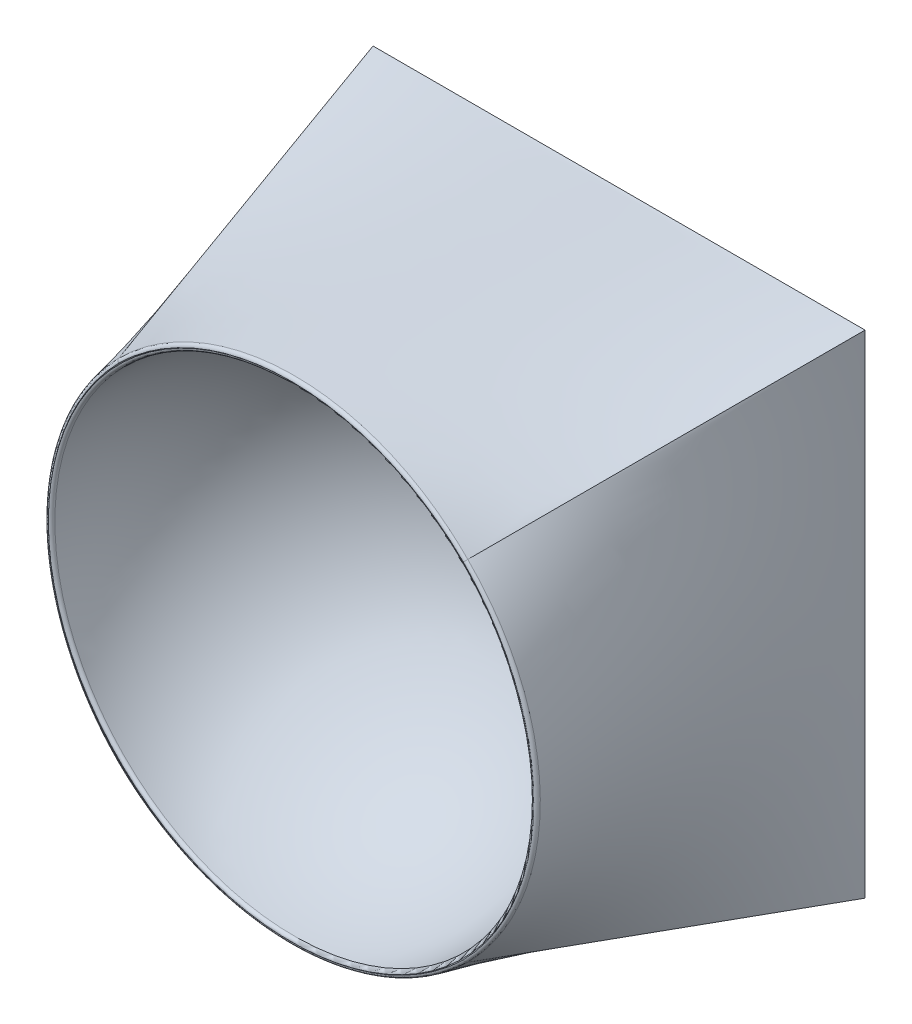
SolidWorks part; units mm, degrees
ref_plane "Front Plane" through (0, 0, 0) normal (0, 0, 1) x (1, 0, 0)
ref_plane "Top Plane" through (0, 0, 0) normal (0, 1, 0) x (1, 0, 0)
ref_plane "Right Plane" through (0, 0, 0) normal (1, 0, 0) x (0, 0, -1)
sketch "Sketch1" plane through (0, 0, 0) normal (0, 0, 1) x (1, 0, 0)
  line L1 (0, 0) -> (150, 0)
  line L2 (0, 0) -> (0, 150)
  line L3 (0, 150) -> (150, 150)
  line L4 (150, 0) -> (150, 150)
  dimension "D1" = 150
ref_plane "Plane4" through (0, 0, 100) normal (0, 0, 1) x (1, 0, 0)
sketch "Sketch2" plane through (0, 0, 100) normal (0, 0, 1) x (1, 0, 0)
  line L0 (0, 150) -> (150, 0) construction
  line L1 (0, 0) -> (150, 0) construction
  circle A0 centre (75, 75) radius 75
loft "Loft1" add profiles "Sketch1", "Sketch2"
sketch "Sketch3" plane through (0, 0, 100) normal (0, 0, 1) x (1, 0, 0)
  line L0 (75, 148) -> (75, 2) construction
  line L1 (75, 148) -> (75, 2)
  arc A10 (126.6188, 126.6188) -> (23.3812, 126.6188) centre (75, 75) ccw
  arc A11 (23.3812, 126.6188) -> (23.3812, 23.3812) centre (75, 75) ccw
  arc A12 (23.3812, 23.3812) -> (126.6188, 23.3812) centre (75, 75) ccw
  arc A13 (126.6188, 23.3812) -> (126.6188, 126.6188) centre (75, 75) ccw
  arc A14 (126.6188, 126.6188) -> (75, 148) centre (75, 75) ccw
  arc A16 (75, 2) -> (126.6188, 23.3812) centre (75, 75) ccw
  arc A17 (126.6188, 23.3812) -> (126.6188, 126.6188) centre (75, 75) ccw
  dimension "D1" = 2
revolve "Cut-Revolve2" cut sketch "Sketch3" angle 360 about L0
fillet "Fillet4" radius 1 6 edges at (79.3709, 149.8725, 100) (0.1275, 79.3709, 100) (70.6291, 0.1275, 100) (149.8725, 70.6291, 100) (148, 75, 100)
